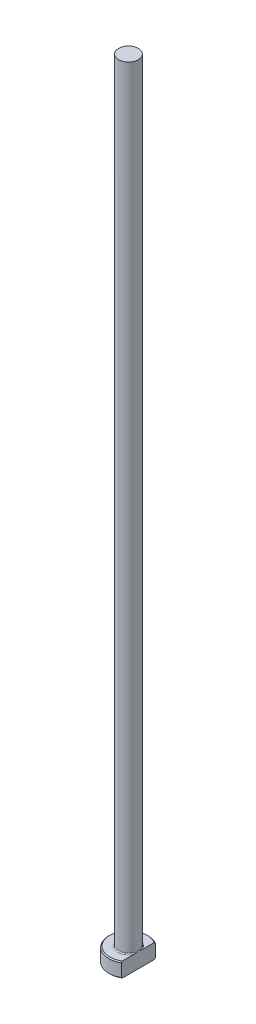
SolidWorks part; units mm, degrees
ref_plane "Front Plane" through (0, 0, 0) normal (0, 0, 1) x (1, 0, 0)
ref_plane "Top Plane" through (0, 0, 0) normal (0, 1, 0) x (1, 0, 0)
ref_plane "Right Plane" through (0, 0, 0) normal (1, 0, 0) x (0, 0, -1)
sketch "Sketch1" plane through (0, 0, 0) normal (0, 0, 1) x (1, 0, 0)
  line L0 (0, 259.9588) -> (0, -15.1925) construction
  line L1 (0, 0) -> (-4, 0)
  line L2 (-4, 0) -> (-4, 3)
  line L3 (-4, 3) -> (-2, 3)
  line L4 (-2, 3) -> (-2, 160)
  line L5 (-2, 160) -> (0, 160)
  line L6 (0, 160) -> (0, 0)
  dimension "L" = 160
  dimension "H" = 8
  dimension "T" = 3
  dimension "D" = 4
revolve "Revolve1" add sketch "Sketch1" angle 360 about L0
chamfer "Chamfer1" distance 0.2 angle 45 2 edges at (0, 3, 4) (0, 0, 4)
fillet "Fillet1" radius 0.2 1 edges at (0, 3, 2)
sketch "Sketch2" plane through (0, 0, 0) normal (0, 1, 0) x (1, 0, 0)
  line L0 (2, 3.4641) -> (2, -3.4641)
  circle A0 centre (0, 0) radius 4 construction
  arc A1 (2, -3.4641) -> (2, 3.4641) centre (0, 0) ccw
  circle A2 centre (0, 0) radius 2 construction
extrude "KEY" cut sketch "Sketch2" along normal through all
